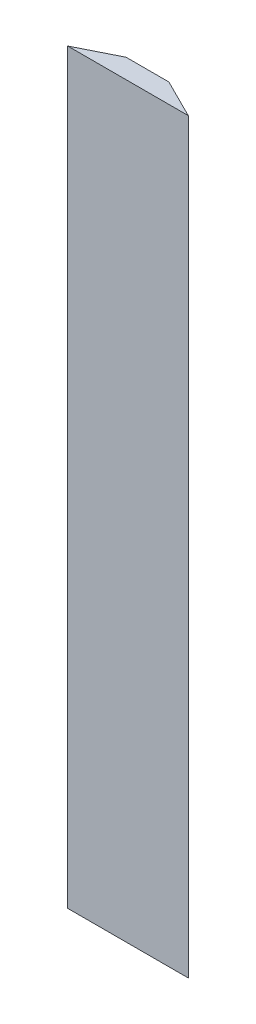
SolidWorks part; units mm, degrees
ref_plane "Front" through (0, 0, 0) normal (0, 0, 1) x (1, 0, 0)
ref_plane "Top" through (0, 0, 0) normal (0, 1, 0) x (1, 0, 0)
ref_plane "Right" through (0, 0, 0) normal (1, 0, 0) x (0, 0, -1)
sketch "Sketch1" plane through (0, 0, 0) normal (0, 1, 0) x (1, 0, 0)
  line L0 (-98.425, 0) -> (-34.925, 31.75)
  line L1 (-34.925, 31.75) -> (34.925, 31.75)
  line L2 (34.925, 31.75) -> (98.425, 0)
  line L3 (98.425, 0) -> (-98.425, 0)
  dimension "D1" = 69.85
  dimension "D2" = 31.75
  dimension "D3" = 196.85
extrude "Boss-Extrude1" add sketch "Sketch1" along normal blind 1219.2
